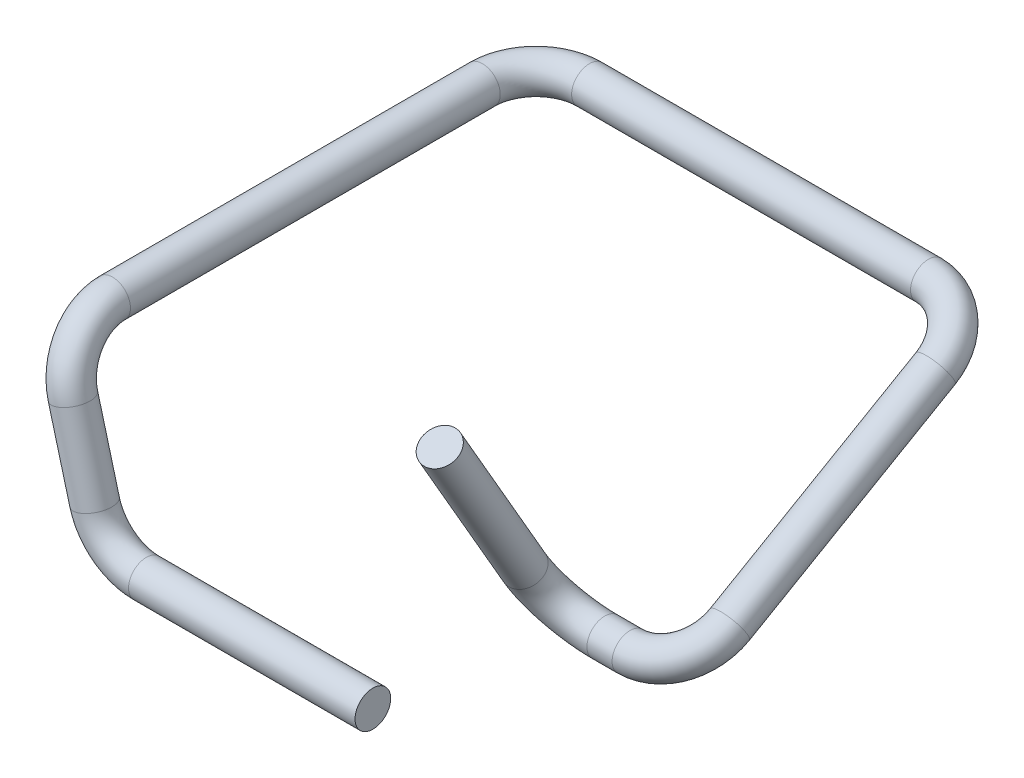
SolidWorks part; units mm, degrees
ref_plane "Front" through (0, 0, 0) normal (0, 0, 1) x (1, 0, 0)
ref_plane "Top" through (0, 0, 0) normal (0, 1, 0) x (1, 0, 0)
ref_plane "Right" through (0, 0, 0) normal (1, 0, 0) x (0, 0, -1)
sketch "setup" plane through (0, 0, 0) normal (0, 1, 0) x (1, 0, 0)
  line L1 (0, 0) -> (-150, 0)
  line L2 (0, 0) -> (0, 100)
  line L3 (0, 100) -> (-150, 100)
  line L4 (-150, 0) -> (-150, 100)
  dimension "D1" = 150
  dimension "D2" = 100
ref_plane "Angle 60" through (0, -43.3013, -25) normal (0, 0.866, 0.5) x (-1, 0, 0)
ref_plane "Angle 15" through (-139.9519, -37.5, 0) normal (0.9659, 0.2588, 0) x (0, 0, -1)
sketch3d "3DSketch1"
  line L0 (0, 0, 0) -> (-126.9802, 0, 0)
  line L1 (-155.958, 22.2354, 0) -> (-168.1173, 67.6148, 0)
  line L2 (-175.8819, 96.5926, -30) -> (-175.8819, 96.5926, -237.3033)
  line L3 (-145.8819, 96.5926, -267.3033) -> (44.1181, 96.5926, -267.3033)
  line L4 (74.1181, 81.5926, -241.3225) -> (74.1181, 15, -125.9808)
  line L5 (44.1181, 0, -100) -> (30, 0, -100)
  line L6 (0, 25.9808, -85) -> (0, 108.2532, -37.5)
  arc A0 (-126.9802, 0, 0) -> (-155.958, 22.2354, 0) centre (-126.9802, 30, 0) ccw
  arc A1 (-168.1173, 67.6148, 0) -> (-175.8819, 96.5926, -30) centre (-168.1173, 67.6148, -30) ccw
  arc A2 (-175.8819, 96.5926, -237.3033) -> (-145.8819, 96.5926, -267.3033) centre (-145.8819, 96.5926, -237.3033) ccw
  arc A3 (44.1181, 96.5926, -267.3033) -> (74.1181, 81.5926, -241.3225) centre (44.1181, 81.5926, -241.3225) ccw
  arc A4 (74.1181, 15, -125.9808) -> (44.1181, 0, -100) centre (44.1181, 15, -125.9808) ccw
  arc A5 (30, 0, -100) -> (0, 25.9808, -85) centre (30, 25.9808, -85) ccw
  point P11 (-150, 0, 0)
  point P12 (-126.9802, 30, -30)
  point P15 (-175.8819, 96.5926, 0)
  point P16 (-197.0951, 59.8502, -30)
  point P19 (-175.8819, 96.5926, -267.3033)
  point P20 (-145.8819, 66.5926, -237.3033)
  point P23 (74.1181, 96.5926, -267.3033)
  point P24 (44.1181, 55.6118, -256.3225)
  point P27 (74.1181, 0, -100)
  point P28 (44.1181, -10.9808, -140.9808)
  point P31 (0, 0, -100)
  point P32 (30, 40.9808, -110.9808)
  dimension "Radius" = 30
  dimension "D1" = 100
  dimension "D2" = 250
  dimension "D3" = 125
sketch "Sketch1" plane through (0, 0, 0) normal (1, 0, 0) x (0, 0, -1)
  circle A0 centre (0, 0) radius 10
  dimension "D1" = 20
sweep "Base-Sweep" add profiles "Sketch1" path "3DSketch1"
